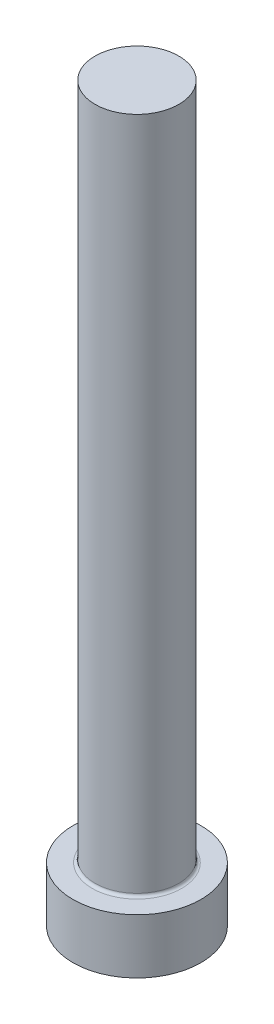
SolidWorks part; units mm, degrees
ref_plane "Front Plane" through (0, 0, 0) normal (0, 0, 1) x (1, 0, 0)
ref_plane "Top Plane" through (0, 0, 0) normal (0, 1, 0) x (1, 0, 0)
ref_plane "Right Plane" through (0, 0, 0) normal (1, 0, 0) x (0, 0, -1)
sketch "Sketch1" plane through (0, 0, 0) normal (0, 0, 1) x (1, 0, 0)
  line L0 (0, 0) -> (0, -1.906) construction
  line L1 (0, 0) -> (5.5499, 0)
  line L2 (5.5499, 0) -> (5.5499, 4.7498)
  line L3 (5.5499, 4.7498) -> (3.8862, 4.7498)
  line L4 (3.6322, 5.0038) -> (3.6322, 63.5)
  line L6 (0, 63.5) -> (3.6322, 63.5)
  line L7 (0, 63.5) -> (0, 0)
  arc A0 (3.8862, 4.7498) -> (3.6322, 5.0038) centre (3.8862, 5.0038) cw
  dimension "D5" = 0.254
  dimension "D" = 7.2644
  dimension "H" = 11.0998
  dimension "D4" = 63.5
  dimension "T" = 4.7498
revolve "Revolve3" add sketch "Sketch1" angle 360 about L0
